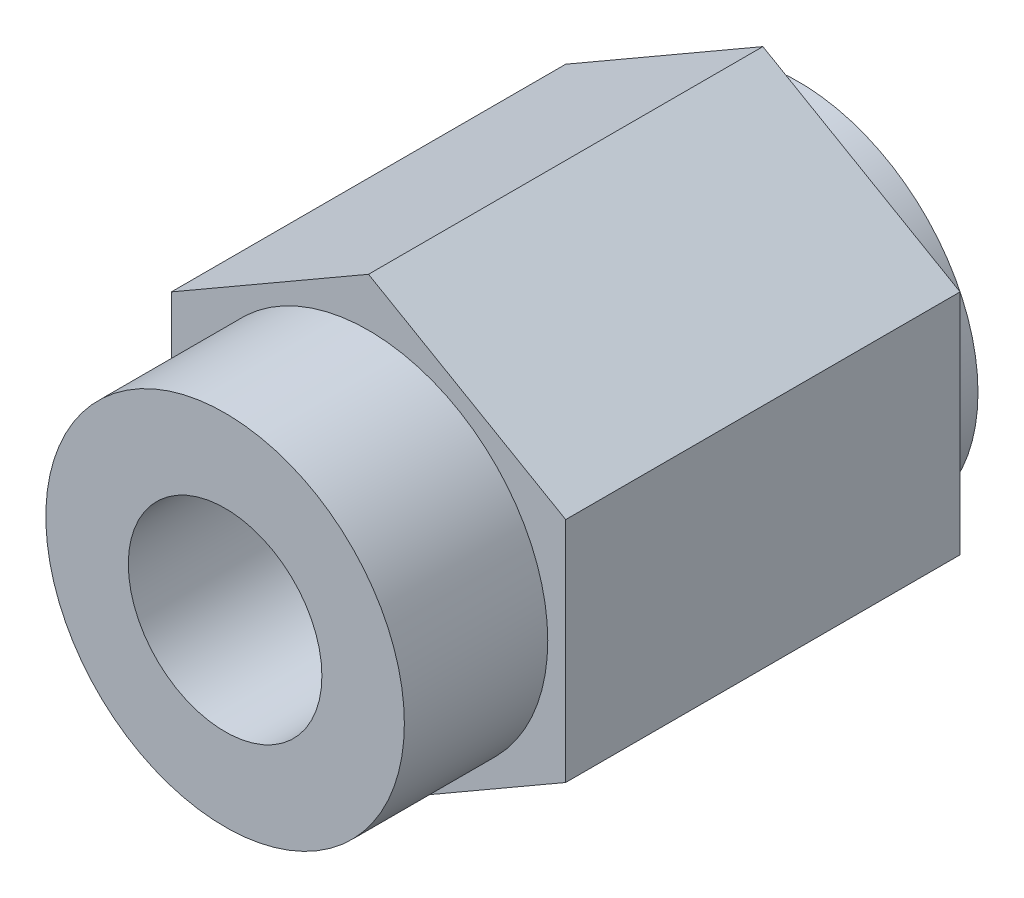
SolidWorks part; units mm, degrees
ref_plane "前视基准面" through (0, 0, 0) normal (0, 0, 1) x (1, 0, 0)
ref_plane "上视基准面" through (0, 0, 0) normal (0, 1, 0) x (1, 0, 0)
ref_plane "右视基准面" through (0, 0, 0) normal (1, 0, 0) x (0, 0, -1)
sketch "草图1" plane through (0, 0, 0) normal (0, 0, 1) x (1, 0, 0)
  line L1 (0, 31.7543) -> (-27.5, 15.8771)
  line L2 (-27.5, 15.8771) -> (-27.5, -15.8771)
  line L3 (-27.5, -15.8771) -> (0, -31.7543)
  line L4 (0, -31.7543) -> (27.5, -15.8771)
  line L5 (27.5, -15.8771) -> (27.5, 15.8771)
  line L6 (27.5, 15.8771) -> (0, 31.7543)
  circle A0 centre (0, 0) radius 27.5 construction
extrude "凸台-拉伸1" add sketch "草图1" along normal blind 55
sketch "草图2" plane through (0, 0, 55) normal (0, 0, 1) x (1, 0, 0)
  circle A0 centre (0, 0) radius 25
extrude "凸台-拉伸2" add sketch "草图2" along normal blind 20
sketch "草图3" plane through (0, 0, 0) normal (0, 0, -1) x (-1, 0, 0)
  circle A0 centre (0, 0) radius 25
extrude "凸台-拉伸3" add sketch "草图3" along normal blind 5
sketch "草图4" plane through (0, 0, -5) normal (0, 0, -1) x (-1, 0, 0)
  circle A0 centre (0, 0) radius 10
extrude "切除-拉伸1" cut sketch "草图4" against normal blind 40
sketch "草图5" plane through (0, 0, 75) normal (0, 0, 1) x (1, 0, 0)
  circle A0 centre (0, 0) radius 13.5
extrude "切除-拉伸2" cut sketch "草图5" against normal blind 40
